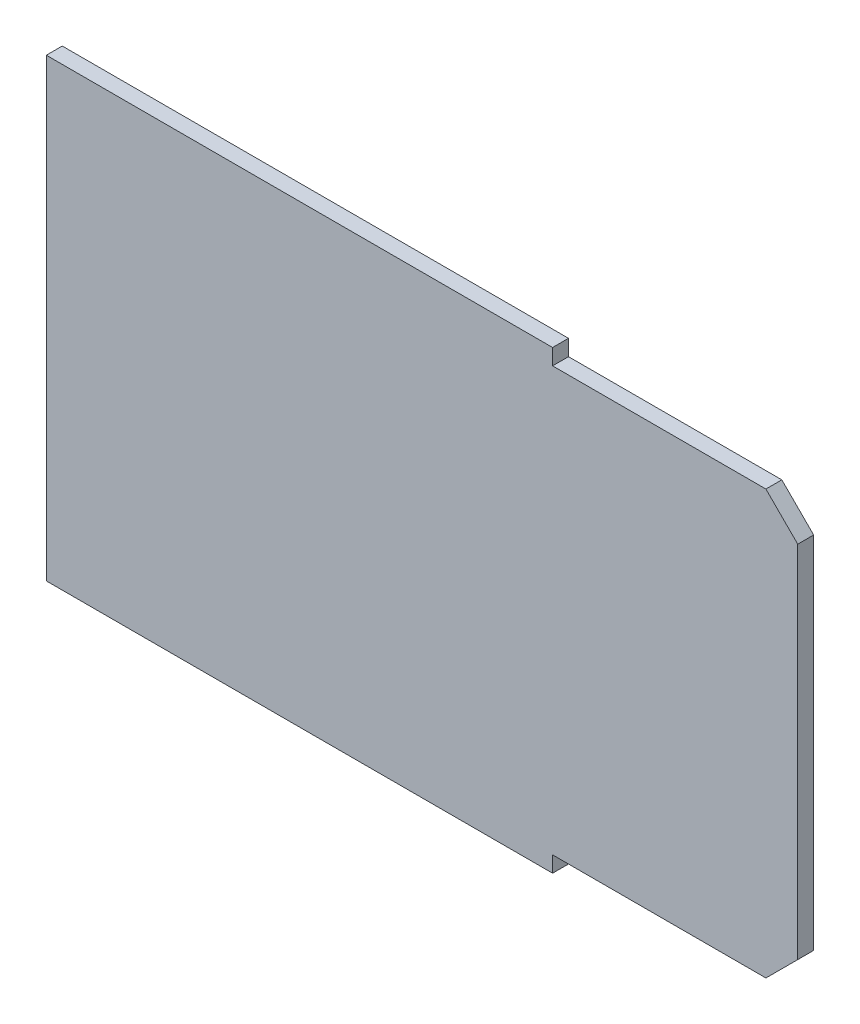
SolidWorks part; units mm, degrees
ref_plane "Plan de face" through (0, 0, 0) normal (0, 0, 1) x (1, 0, 0)
ref_plane "Plan de dessus" through (0, 0, 0) normal (0, 1, 0) x (1, 0, 0)
ref_plane "Plan de droite" through (0, 0, 0) normal (1, 0, 0) x (0, 0, -1)
sketch "Esquisse1" plane through (0, 0, 0) normal (0, 0, 1) x (1, 0, 0)
  line L0 (159, 5) -> (159, 0)
  line L1 (159, 0) -> (0, 0)
  line L2 (0, 0) -> (0, 143)
  line L3 (0, 143) -> (159, 143)
  line L4 (159, 143) -> (159, 138)
  line L5 (159, 138) -> (236, 138)
  line L6 (236, 138) -> (236, 5)
  line L7 (236, 5) -> (159, 5)
  dimension "D1" = 236
  dimension "D2" = 77
  dimension "D3" = 5
  dimension "D4" = 143
extrude "Extrusion1" add sketch "Esquisse1" along normal blind 5
chamfer "Chanfrein1" distance 10 angle 45 2 edges at (236, 5, 2.5) (236, 138, 2.5)
